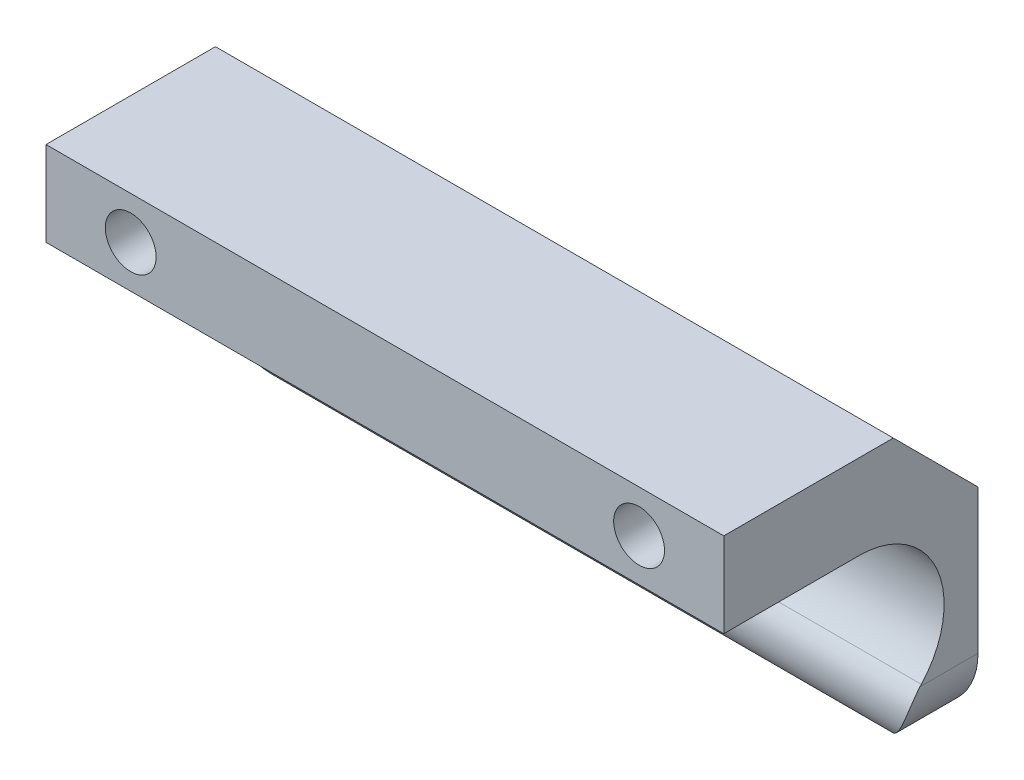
SolidWorks part; units mm, degrees
ref_plane "Front Plane" through (0, 0, 0) normal (0, 0, 1) x (1, 0, 0)
ref_plane "Top Plane" through (0, 0, 0) normal (0, 1, 0) x (1, 0, 0)
ref_plane "Right Plane" through (0, 0, 0) normal (1, 0, 0) x (0, 0, -1)
sketch "Sketch1" plane through (0, 0, 0) normal (1, 0, 0) x (0, 0, -1)
  line L1 (-15, -17.5) -> (15, -17.5)
  line L2 (-15, -17.5) -> (-15, 17.5)
  line L3 (-15, 17.5) -> (15, 17.5)
  line L4 (15, -17.5) -> (15, 17.5)
  line L5 (-15, -17.5) -> (15, 17.5) construction
  line L6 (-15, 17.5) -> (15, -17.5) construction
  point P0 (0, 0)
  dimension "D1" = 30
  dimension "D2" = 35
extrude "Extrude1" add sketch "Sketch1" along normal mid plane 80
chamfer "Chamfer1" distance 10 angle 45 1 edges at (0, 17.5, -15)
sketch "Sketch2" plane through (40, 0, 0) normal (1, 0, 0) x (0, 0, -1)
  line L0 (1, 7.5) -> (-15, 7.5)
  line L2 (-15, 17.5) -> (-15, -17.5) construction
  line L3 (5, 17.5) -> (-15, 17.5) construction
  line L4 (15, -17.5) -> (15, 7.5) construction
  line L7 (-15, -17.5) -> (15, -17.5) construction
  line L8 (15, -16.347) -> (15, -17.5)
  line L9 (15, -17.5) -> (-15, -17.5)
  line L10 (-15, -17.5) -> (-15, 7.5)
  arc A0 (8.3078, -9.3261) -> (15, -16.347) centre (11.8579, -12.6421) ccw
  arc A1 (8.3078, -9.3261) -> (1, 7.5) centre (1, -2.5) ccw
  point P3 (11, -2.5)
  point P16 (7, -12.6421)
  point P18 (11.8579, -17.5)
  dimension "D3" = 10
  dimension "D1" = 10
  dimension "D2" = 4
  dimension "D4" = 8
extrude "Extrude2" cut sketch "Sketch2" against normal blind 80 contours A0 A1 L0 M4 M5 | A0 L9 M1
sketch "Sketch3" plane through (0, 0, -15) normal (0, 0, -1) x (-1, 0, 0)
  line L0 (-40, -17.5) -> (-40, -9.5)
  line L1 (-40, -16.347) -> (-40, 7.5) construction
  line L2 (-40, -17.5) -> (40, -17.5) construction
  line L3 (-32, -17.5) -> (-40, -17.5)
  line L4 (40, -17.5) -> (40, -9.5)
  line L5 (40, -16.347) -> (40, 7.5) construction
  line L6 (40, -17.5) -> (32, -17.5)
  arc A0 (-40, -9.5) -> (-32, -17.5) centre (-32, -9.5) ccw
  arc A1 (32, -17.5) -> (40, -9.5) centre (32, -9.5) ccw
  dimension "D1" = 8
extrude "Extrude3" cut sketch "Sketch3" against normal through all
hole_wizard "M6x1.0 Tapped Hole1" positions "Sketch5" profile "Sketch4" tap size "M6x1.0" standard "Ansi Metric"
sketch "Sketch5" plane through (0, 0, 15) normal (0, 0, 1) x (1, 0, 0)
  line L0 (-40, 17.5) -> (-40, 7.5) construction
  line L1 (40, 17.5) -> (-40, 17.5) construction
  point P0 (-30, 12.5)
  point P2 (-40, 12.5)
  dimension "D1" = 10
  dimension "D2" = 5
sketch "Sketch4" plane through (-30, 12.5, 15) normal (1, 0, 0) x (0, -1, 0)
  line L0 (0, 0) -> (0, 18.5022)
  line L1 (0, 18.5022) -> (2.5, 17)
  line L2 (2.5, 17) -> (2.5, 12)
  line L3 (2.5, 12) -> (3, 12)
  line L4 (3, 12) -> (3, 0)
  line L5 (3, 0) -> (0, 0)
  line L10 (0, 18.5022) -> (-2.5, 17) construction
  line L11 (0, -6.35) -> (0, 107.95) construction
  dimension "Tap Drill Dia." = 5
  dimension "Tap Drill Depth" = 17
  dimension "Thread Major Dia." = 6
  dimension "Thread Depth" = 12
  dimension "Drill Angle" = 118
mirror "Mirror1" about plane through (0, 0, 0) normal (1, 0, 0) of "M6x1.0 Tapped Hole1"
